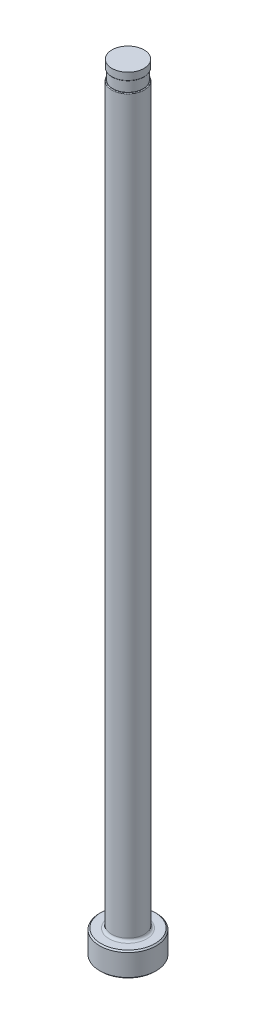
SolidWorks part; units mm, degrees
ref_plane "Front Plane" through (0, 0, 0) normal (0, 0, 1) x (1, 0, 0)
ref_plane "Top Plane" through (0, 0, 0) normal (0, 1, 0) x (1, 0, 0)
ref_plane "Right Plane" through (0, 0, 0) normal (1, 0, 0) x (0, 0, -1)
other "Configuration Table"
sketch "Sketch1" plane through (0, 0, 0) normal (0, 0, 1) x (1, 0, 0)
  line L0 (0, 259.9588) -> (0, -15.1925) construction
  line L1 (0, 0) -> (-5.5499, 0)
  line L2 (-5.5499, 0) -> (-5.5499, 4.7498)
  line L3 (-5.5499, 4.7498) -> (-3.175, 4.7498)
  line L4 (-3.175, 4.7498) -> (-3.175, 152.4)
  line L5 (-3.175, 152.4) -> (0, 152.4)
  line L6 (0, 152.4) -> (0, 0)
  dimension "L" = 152.4
  dimension "H" = 11.0998
  dimension "T" = 4.7498
  dimension "D" = 6.35
revolve "Revolve1" add sketch "Sketch1" angle 360 about L0
chamfer "Chamfer1" distance 0.254 angle 45 2 edges at (0, 4.7498, 5.5499) (0, 0, 5.5499)
fillet "Fillet1" radius 0.508 1 edges at (0, 4.7498, 3.175)
sketch "Sketch2" plane through (0, 0, 0) normal (0, 0, 1) x (1, 0, 0)
  line L0 (-3.175, 152.4) -> (-3.175, 5.2578) construction
  line L1 (-3.175, 150.876) -> (-2.9718, 150.876)
  line L2 (-3.175, 150.876) -> (-3.175, 148.844)
  line L3 (-3.175, 148.844) -> (-2.9718, 148.844)
  line L4 (-2.9718, 150.876) -> (-2.9718, 148.844)
  line L5 (3.175, 152.4) -> (-3.175, 152.4) construction
  line L6 (0, 153.4483) -> (0, 147.3282) construction
  dimension "D1" = 2.032
  dimension "N" = 1.524
  dimension "FD" = 0.2032
  dimension "D3" = 5.9436
revolve "Vent Relief" cut sketch "Sketch2" angle 360 about L6
sketch "Sketch3" plane through (0, 0, 0) normal (0, 0, 1) x (1, 0, 0)
  line L0 (-2.9718, 149.86) -> (-2.9718, 86.36)
  line L1 (-2.9718, 150.876) -> (-2.9718, 148.844) construction
  line L2 (-3.175, 148.844) -> (-3.175, 5.2578) construction
  line L3 (-3.175, 85.2424) -> (-3.175, 149.86)
  line L4 (-3.175, 149.86) -> (-2.9718, 149.86)
  arc A0 (-2.9718, 86.36) -> (-3.175, 85.2424) centre (-6.1468, 86.36) cw
  dimension "D1" = 3.175
  dimension "D2" = 63.5
extrude "D-Slot" cut sketch "Sketch3" against normal through all both and the other way through all
sketch "Sketch5" plane through (0, 0, 0) normal (0, 0, 1) x (1, 0, 0)
  line L0 (-3.175, 150.876) -> (3.175, 150.876) construction
  line L1 (-3.175, 152.4) -> (-3.1496, 152.4)
  line L2 (-3.175, 152.4) -> (-3.175, 150.876)
  line L3 (-3.175, 150.876) -> (-3.1496, 150.876)
  line L4 (-3.1496, 152.4) -> (-3.1496, 150.876)
  line L5 (0, 152.6877) -> (0, 150.5771) construction
  dimension "VP" = 0.0254
revolve "Vent Diameter" cut sketch "Sketch5" angle 360 about L5
fillet "Fillet2" radius 0.127 2 edges at (3.175, 148.844, 0) (0, 150.876, 3.1496)
sketch "Pocket Sketch" plane through (0, 0, 0) normal (0, 0, 1) x (1, 0, 0)
  line L0 (-5.9468, 0) -> (-5.9468, 4.7752)
  line L1 (-5.9468, 4.7752) -> (-4.1354, 4.7752)
  line L2 (-3.3734, 5.5372) -> (-3.3734, 22.225)
  line L3 (-3.3734, 22.225) -> (0, 22.225)
  line L4 (0, 22.225) -> (0, 0)
  line L5 (0, 0) -> (-5.9468, 0)
  line L6 (0, 12.6104) -> (0, -2.4989) construction
  line L7 (-5.5499, 4.4958) -> (-5.5499, 0.254) construction
  line L8 (5.2959, 4.7498) -> (-5.2959, 4.7498) construction
  line L9 (-3.175, 85.2424) -> (-3.175, 5.2578) construction
  line L10 (-4.1354, 4.7752) -> (-3.3734, 5.5372)
  point P3 (-3.3734, 4.7752)
  dimension "D1" = 11.8935
  dimension "D2" = 0.3969
  dimension "D3" = 0.0254
  dimension "D4" = 0.1984
  dimension "D5" = 6.7469
  dimension "D6" = 22.225
